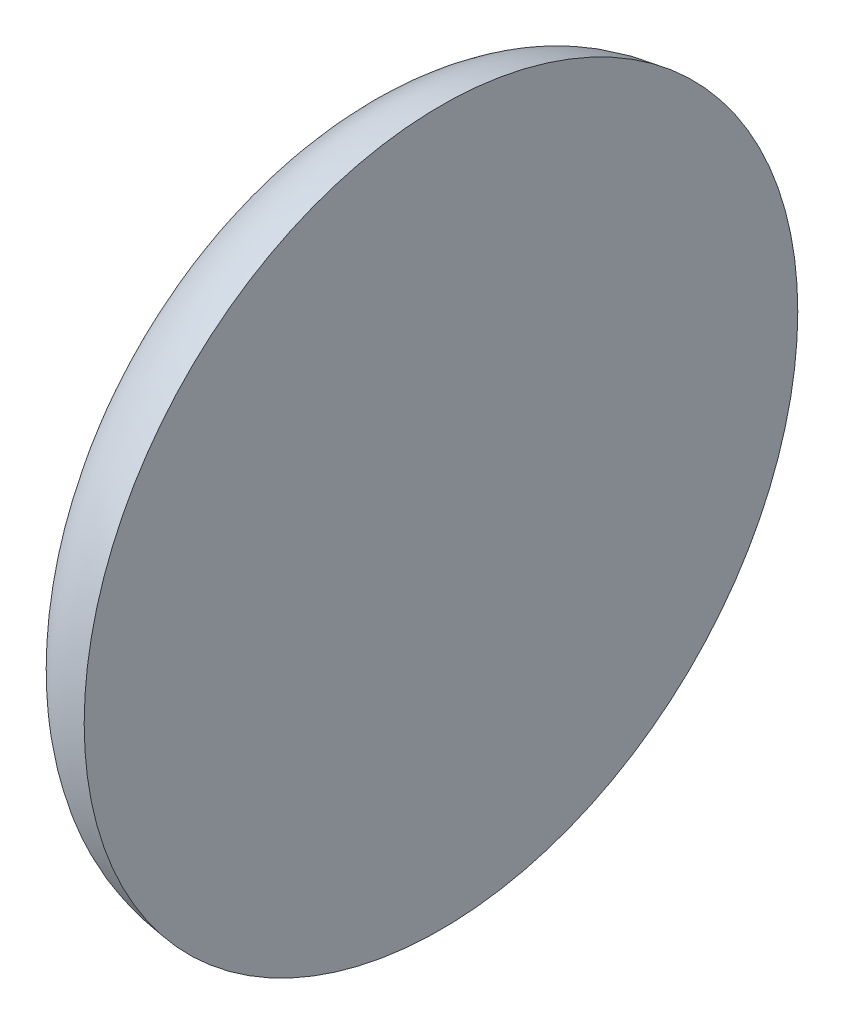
SolidWorks part; units mm, degrees
ref_plane "前视基准面" through (0, 0, 0) normal (0, 0, 1) x (1, 0, 0)
ref_plane "上视基准面" through (0, 0, 0) normal (0, 1, 0) x (1, 0, 0)
ref_plane "右视基准面" through (0, 0, 0) normal (1, 0, 0) x (0, 0, -1)
sketch "草图2" plane through (0, 0, 0) normal (0, 1, 0) x (1, 0, 0)
  line L0 (0, 0) -> (10.7319, 0) construction
  line L1 (7, 0) -> (7, 6)
  line L3 (5, 3) -> (5, 0)
  line L7 (5, 0) -> (7, 0)
  spline S0 degree 3 poles (7, 6) (6.7809, 5.9718) (6.3304, 5.9137) (5.8377, 5.515) (5.4582, 4.9735) (5.1044, 4.1602) (5.0398, 3.4427) (5, 3) knots 0 0 0 0 0.164642 0.338511 0.458081 0.665681 1 1 1 1
  dimension "D1" = 2
  dimension "D2" = 6
revolve "旋转1" add sketch "草图2" angle 360 about L0
sketch "Orientation Sketch" plane through (7, 0, 0) normal (1, 0, 0) x (0, 0, -1)
  circle A0 centre (0, 0) radius 6 construction
  circle A1 centre (0, 0) radius 6
other "成形工具1" parameters "厚度"=2
